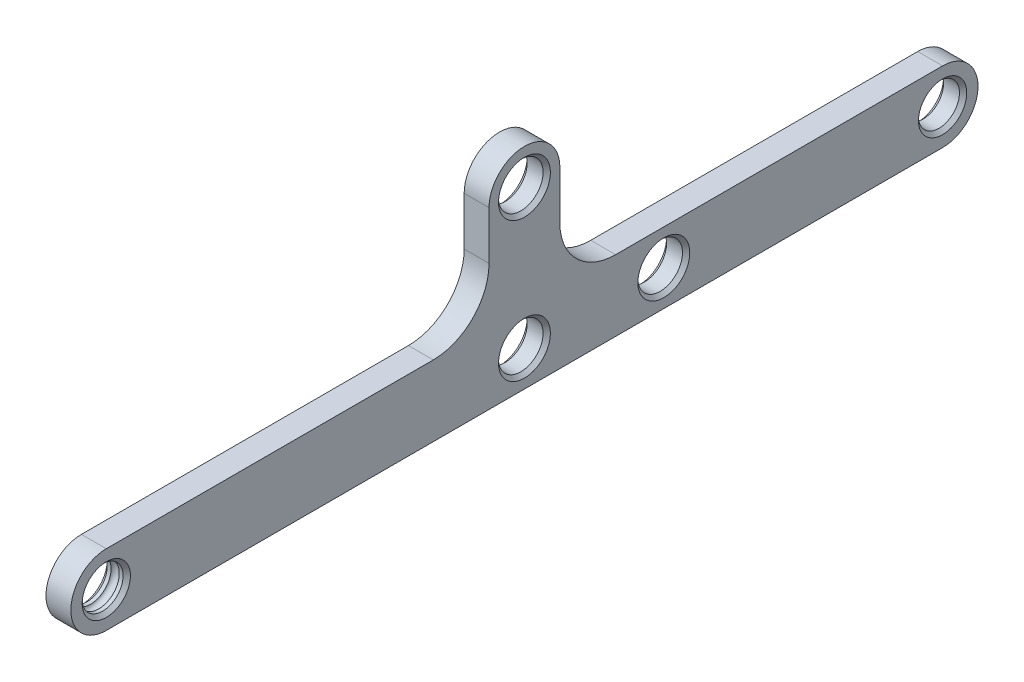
SolidWorks part; units mm, degrees
ref_plane "Front Plane" through (0, 0, 0) normal (0, 0, 1) x (1, 0, 0)
ref_plane "Top Plane" through (0, 0, 0) normal (0, 1, 0) x (1, 0, 0)
ref_plane "Right Plane" through (0, 0, 0) normal (1, 0, 0) x (0, 0, -1)
sketch "Sketch1" plane through (0, 0, 0) normal (1, 0, 0) x (0, 0, -1)
  line L0 (0, 0) -> (150, 0) construction
  line L1 (0, 6.35) -> (150, 6.35)
  line L2 (0, -6.35) -> (150, -6.35)
  line L3 (75, 0) -> (75, 25) construction
  line L4 (68.65, 0) -> (68.65, 25)
  line L5 (81.35, 0) -> (81.35, 25)
  arc A0 (0, 6.35) -> (0, -6.35) centre (0, 0) ccw
  arc A1 (150, -6.35) -> (150, 6.35) centre (150, 0) ccw
  circle A2 centre (0, 0) radius 3.175
  circle A3 centre (150, 0) radius 3.175
  arc A4 (68.65, 0) -> (81.35, 0) centre (75, 0) ccw
  arc A5 (81.35, 25) -> (68.65, 25) centre (75, 25) ccw
  circle A6 centre (75, 0) radius 4
  circle A7 centre (75, 25) radius 4
  circle A8 centre (0, 0) radius 3.675
  circle A9 centre (150, 0) radius 3.675
  circle A10 centre (30, 0) radius 4 construction
  circle A11 centre (100, 0) radius 4
  point P3 (75, 0)
  point P14 (75, 12.5)
  dimension "D2" = 6.35
  dimension "D3" = 6.35
  dimension "D4" = 6.35
  dimension "D6" = 6.35
  dimension "D7" = 8
  dimension "D8" = 8
  dimension "D11" = 30
  dimension "D12" = 50
  dimension "D1" = 150
  dimension "D5" = 25
  dimension "D9" = 0.5
  dimension "D10" = 0.5
extrude "Boss-Extrude1" add sketch "Sketch1" along normal blind 4.7625 contours A4 L4 L1 A0 L2 A10 A8 | A4 L2 A1 L1 L5 A11 A9 | L4 A4 L5 L1 A6 | L5 A5 L4 L1 A7
chamfer "Chamfer1" distance 0.9525 angle 45 10 edges at (4.7625, 0, -3.675) (0, 0, -3.675) (4.7625, 0, -153.675) (0, 0, -153.675) (4.7625, 0, -104) (0, 0, -104) (4.7625, 0, -79) (0, 0, -79) (4.7625, 25, -79) (0, 25, -79)
sketch "Sketch2" plane through (0, 0, 0) normal (0, 1, 0) x (1, 0, 0)
  line L0 (3.81, 3.675) -> (3.81, -3.675) construction
  line L1 (0.4525, -3.675) -> (5.2078, -3.675) construction
  line L2 (0.4525, 3.675) -> (0.4525, -3.675)
  line L3 (0.4525, 3.675) -> (0.4525, -3.675) construction
  line L4 (3.81, 3.675) -> (3.81, -3.675) construction
  line L5 (4.7625, -6.35) -> (4.7625, 0) construction
  line L6 (0.4525, 0) -> (3.81, 0)
  circle A0 centre (2.3813, -3.375) radius 0.7938
  dimension "D2" = 1.5875
  dimension "D4" = 2.3813
  dimension "D3" = 0.3
  dimension "D1" = 0.5
revolve "Cut-Revolve1" cut sketch "Sketch2" angle 360 about L6
sketch "Sketch5" plane through (4.7625, 0, 0) normal (1, 0, 0) x (0, 0, -1)
  line L5 (0, -6.35) -> (150, -6.35)
  line L6 (150, 6.35) -> (81.35, 6.35)
  line L7 (81.35, 6.35) -> (81.35, 25)
  line L8 (68.65, 25) -> (68.65, 6.35)
  line L9 (68.65, 6.35) -> (0, 6.35)
  line L10 (0, -6.35) -> (150, -6.35)
  line L11 (150, 6.35) -> (81.35, 6.35)
  line L12 (81.35, 6.35) -> (81.35, 25)
  line L13 (68.65, 25) -> (68.65, 6.35)
  line L14 (68.65, 6.35) -> (0, 6.35)
  arc A3 (150, -6.35) -> (150, 6.35) centre (150, 0) ccw
  arc A4 (81.35, 25) -> (68.65, 25) centre (75, 25) ccw
  arc A5 (0, 6.35) -> (0, -6.35) centre (0, 0) ccw
  arc A6 (150, -6.35) -> (150, 6.35) centre (150, 0) ccw
  arc A7 (81.35, 25) -> (68.65, 25) centre (75, 25) ccw
  arc A8 (0, 6.35) -> (0, -6.35) centre (0, 0) ccw
  dimension "D1" = 0
extrude "Cut-Extrude1" cut sketch "Sketch5" against normal blind 0.3
fillet "Fillet1" radius 10 2 edges at (2.2313, 6.35, -68.65) (2.2313, 6.35, -81.35)
sketch "Sketch6" plane through (0, 0, 0) normal (-1, 0, 0) x (0, 0, 1)
  point P0 (-75, 0)
  point P1 (-75, 25)
  point P3 (-100, 0)
sketch "Sketch7" plane through (0, 0, 0) normal (-1, 0, 0) x (0, 0, 1)
  point P0 (-63.9742, 100.058)
  point P1 (0, 0)
  point P2 (-150, 0)
  point P3 (-179.6608, -24.958)
